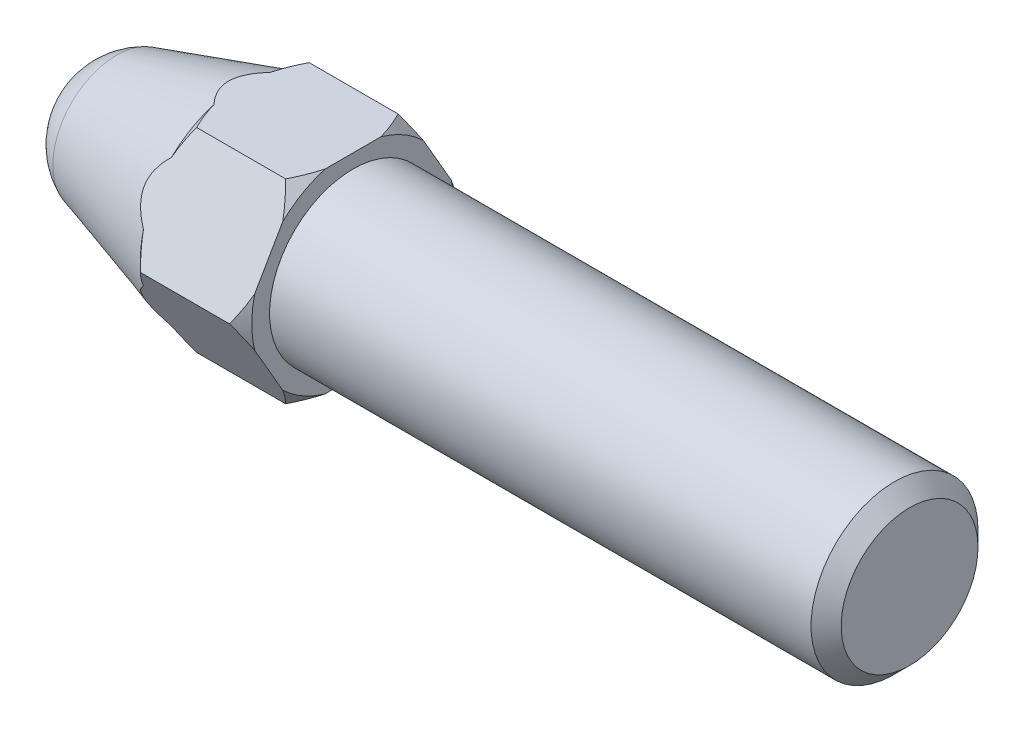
SolidWorks part; units mm, degrees
ref_plane "Plan de face" through (0, 0, 0) normal (0, 0, 1) x (1, 0, 0)
ref_plane "Plan de dessus" through (0, 0, 0) normal (0, 1, 0) x (1, 0, 0)
ref_plane "Plan de droite" through (0, 0, 0) normal (1, 0, 0) x (0, 0, -1)
imported_body "Importée3"
sketch "Esquisse1" plane through (0, 0, 0) normal (0, 0, 1) x (1, 0, 0)
  line L0 (0, 3) -> (0, 0)
  line L1 (0, 0) -> (20, 0)
  line L2 (20, 0) -> (20, 3)
  line L3 (20, 3) -> (0, 3)
  line L4 (0, 0) -> (20, 0) construction
  dimension "D1" = 20
revolve "Révolution1" add sketch "Esquisse1" angle 360 about L4
chamfer "Chanfrein1" distance 0.5413 angle 45 1 edges at (20, 0, -3)
ref_plane "Plan1" through (-10, 0, 0) normal (-1, 0, 0) x (0, 0, 1)
ref_point "Point1"
